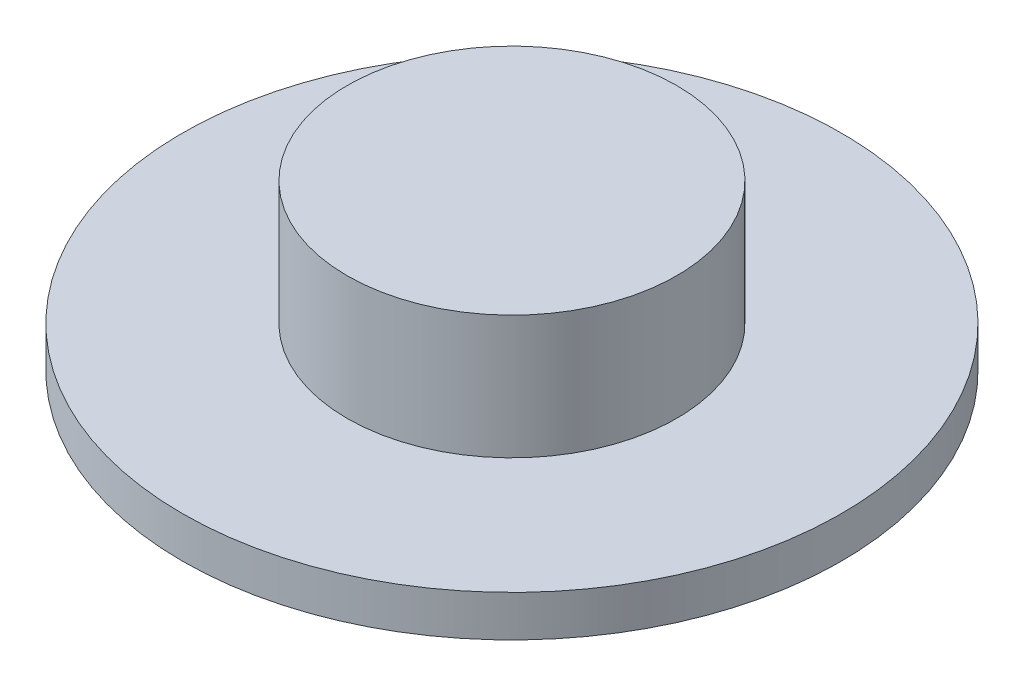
SolidWorks part; units mm, degrees
ref_plane "Front Plane" through (0, 0, 0) normal (0, 0, 1) x (1, 0, 0)
ref_plane "Top Plane" through (0, 0, 0) normal (0, 1, 0) x (1, 0, 0)
ref_plane "Right Plane" through (0, 0, 0) normal (1, 0, 0) x (0, 0, -1)
sketch "Sketch1" plane through (0, 0, 0) normal (0, 1, 0) x (1, 0, 0)
  circle A0 centre (0, 0) radius 80
extrude "Boss-Extrude1" add sketch "Sketch1" along normal blind 10
sketch "Sketch2" plane through (0, 0, 0) normal (0, 1, 0) x (1, 0, 0)
  circle A0 centre (0, 0) radius 40
extrude "Boss-Extrude2" add sketch "Sketch2" along normal blind 40
